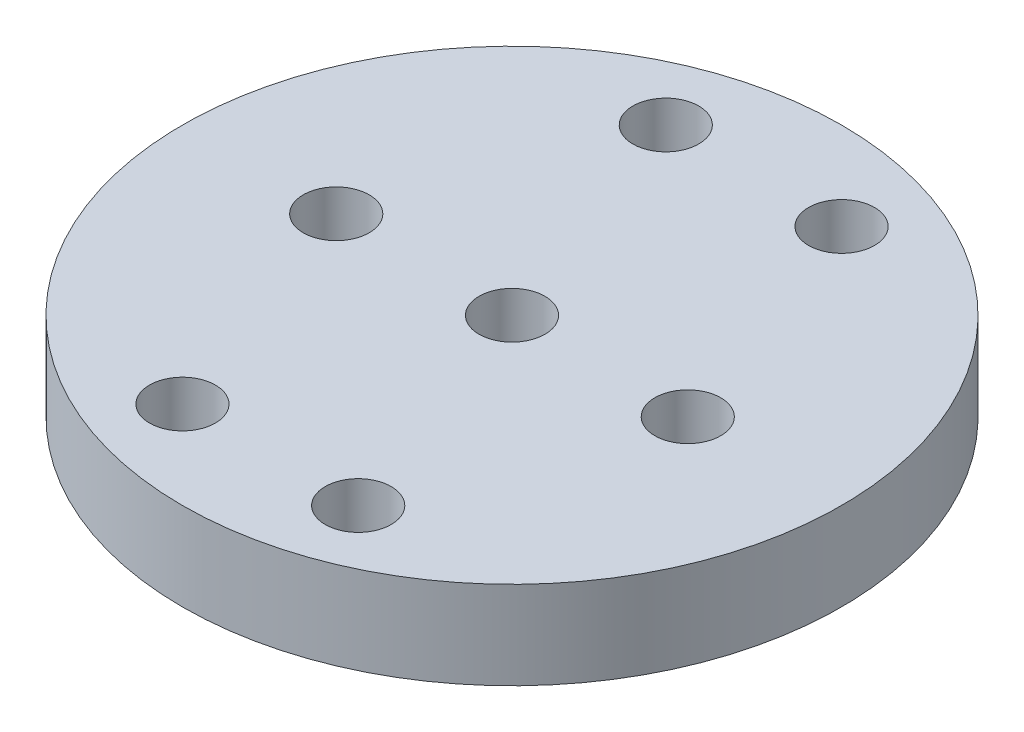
SolidWorks part; units mm, degrees
ref_plane "Front" through (0, 0, 0) normal (0, 0, 1) x (1, 0, 0)
ref_plane "Top" through (0, 0, 0) normal (0, 1, 0) x (1, 0, 0)
ref_plane "Right" through (0, 0, 0) normal (1, 0, 0) x (0, 0, -1)
sketch "Sketch1" plane through (0, 0, 0) normal (0, 1, 0) x (1, 0, 0)
  circle A0 centre (0, 0) radius 75
  dimension "D1" = 150
extrude "Extrude1" add sketch "Sketch1" along normal blind 20
sketch "Sketch3" plane through (0, 20, 0) normal (0, 1, 0) x (-1, 0, 0)
  circle A0 centre (0, 0) radius 7.5
  dimension "D1" = 15
extrude "Cut-Extrude1" cut sketch "Sketch3" against normal through all
sketch "Sketch2" plane through (0, 20, 0) normal (0, 1, 0) x (-1, 0, 0)
  point P0 (20, -55)
  point P1 (40, 0)
  point P2 (20, 55)
  point P3 (-40, 0)
  point P4 (-20, -55)
  point P6 (-20, 55)
  dimension "D1" = 40
  dimension "D2" = 20
  dimension "D3" = 60
  dimension "D4" = 80
  dimension "D5" = 55
  dimension "D6" = 55
pattern_sketch "Sketch-Pattern1" of "Cut-Extrude1"
